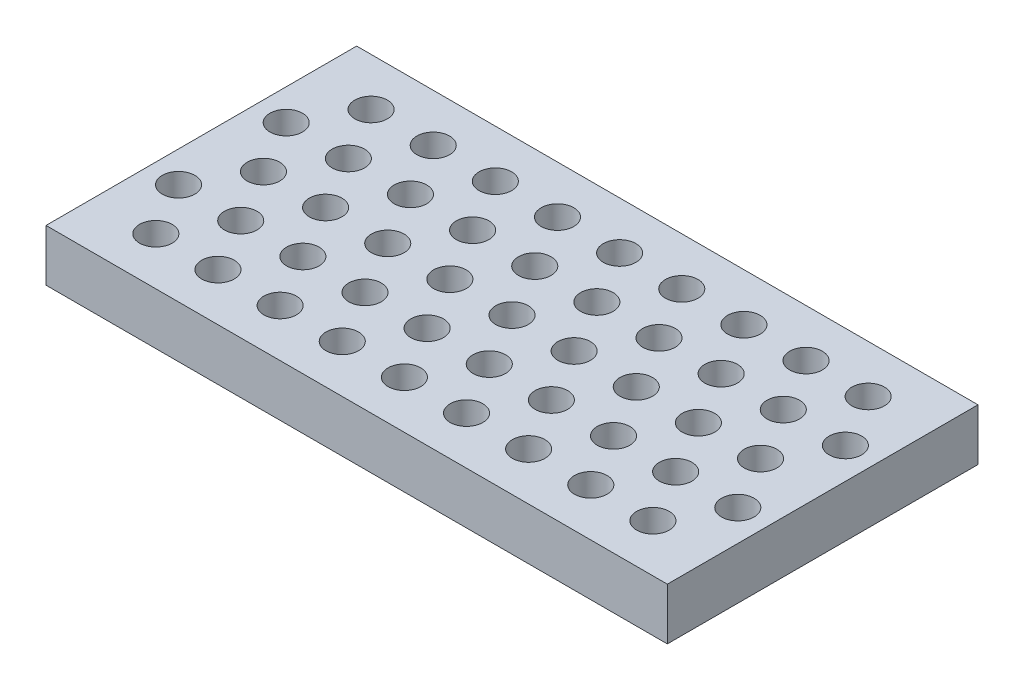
SolidWorks part; units mm, degrees
ref_plane "Front Plane" through (0, 0, 0) normal (0, 0, 1) x (1, 0, 0)
ref_plane "Top Plane" through (0, 0, 0) normal (0, 1, 0) x (1, 0, 0)
ref_plane "Right Plane" through (0, 0, 0) normal (1, 0, 0) x (0, 0, -1)
sketch "Sketch1" plane through (0, 0, 0) normal (0, 1, 0) x (1, 0, 0)
  line L1 (-76.2, 38.1) -> (76.2, 38.1)
  line L2 (-76.2, 38.1) -> (-76.2, -38.1)
  line L3 (-76.2, -38.1) -> (76.2, -38.1)
  line L4 (76.2, 38.1) -> (76.2, -38.1)
  dimension "D1" = 152.4
  dimension "D2" = 76.2
  dimension "D3" = 76.2
  dimension "D4" = 38.1
extrude "Extrude1" add sketch "Sketch1" along normal blind 12.7
other "Fill Pattern3" parameters "D10"=8, "D5"=0, "D6"=0, "D1"=15.24, "D2"=60, "D3"=2.54, "D9"=47
